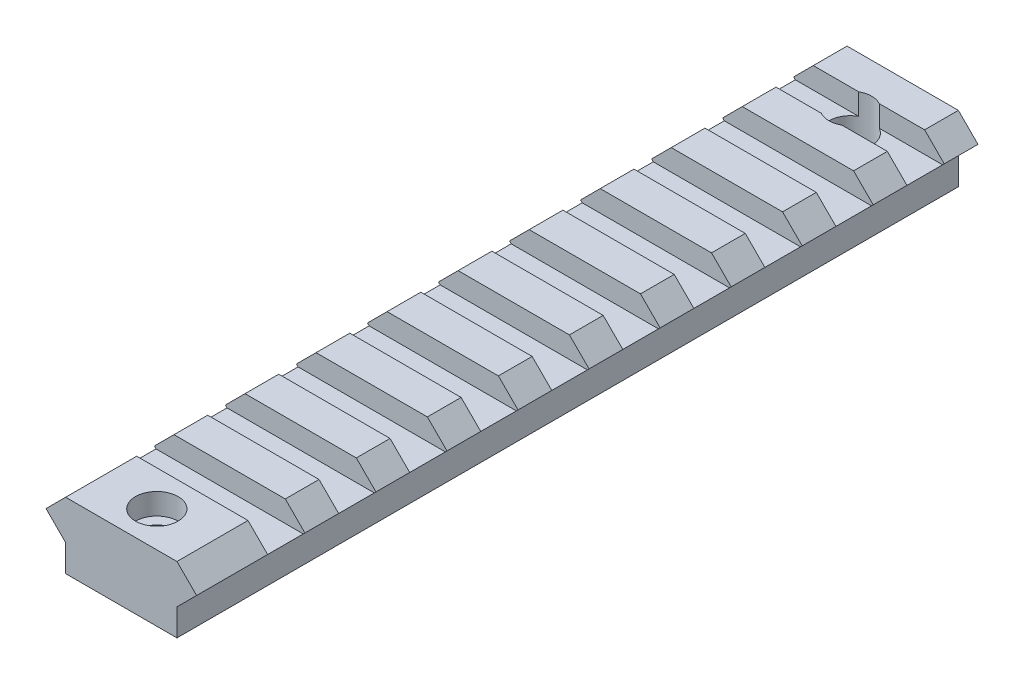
SolidWorks part; units mm, degrees
ref_plane "前视基准面" through (0, 0, 0) normal (0, 0, 1) x (1, 0, 0)
ref_plane "上视基准面" through (0, 0, 0) normal (0, 1, 0) x (1, 0, 0)
ref_plane "右视基准面" through (0, 0, 0) normal (1, 0, 0) x (0, 0, -1)
other "Configuration Table"
sketch "草图2" plane through (0, 0, 0) normal (0, 0, 1) x (1, 0, 0)
  line L0 (-26.0262, 29.9696) -> (-28.7912, 27.2046)
  line L1 (-28.7912, 29.9696) -> (-7.5912, 29.9696)
  line L2 (-28.7912, 29.9696) -> (-28.7912, 20.6496)
  line L3 (-28.7912, 20.6496) -> (-7.5912, 20.6496)
  line L4 (-7.5912, 29.9696) -> (-7.5912, 20.6496)
  line L5 (-28.7912, 29.9696) -> (-7.5912, 20.6496) construction
  line L6 (-28.7912, 20.6496) -> (-7.5912, 29.9696) construction
  line L7 (-26.0262, 20.6496) -> (-10.3562, 20.6496)
  line L8 (-26.0262, 20.6496) -> (-26.0262, 29.9696)
  line L9 (-26.0262, 29.9696) -> (-10.3562, 29.9696)
  line L10 (-10.3562, 20.6496) -> (-10.3562, 29.9696)
  line L11 (-26.0262, 20.6496) -> (-10.3562, 29.9696) construction
  line L12 (-26.0262, 29.9696) -> (-10.3562, 20.6496) construction
  line L13 (-28.7912, 27.2046) -> (-26.0262, 24.4396)
  line L14 (-18.1912, 29.9696) -> (-18.1912, 20.6496) construction
  line L15 (-7.5912, 27.2046) -> (-10.3562, 24.4396)
  line L16 (-10.3562, 29.9696) -> (-7.5912, 27.2046)
  point P0 (-18.1912, 25.3096)
  point P5 (-18.1912, 25.3096)
  dimension "D1" = 9.32
  dimension "D2" = 21.2
  dimension "D3" = 9.32
  dimension "D4" = 15.67
  dimension "D5" = 45
  dimension "D6" = 45
  dimension "D7" = 2.765
  dimension "D8" = 2.765
  dimension "D9" = 3.79
extrude "凸台-拉伸1" add sketch "草图2" along normal blind 110 contours L0 L13 L8 | L3 L10 L1 L8 | L16 L10 L15
sketch "草图3" plane through (0, 29.9696, 0) normal (0, 1, 0) x (1, 0, 0)
  line L1 (-28.7912, -4.75) -> (-7.5912, -4.75)
  line L2 (-28.7912, -4.75) -> (-28.7912, -10)
  line L3 (-28.7912, -10) -> (-7.5912, -10)
  line L4 (-7.5912, -4.75) -> (-7.5912, -10)
  line L6 (-28.7912, -14.75) -> (-28.7912, -20)
  line L7 (-26.0262, 0) -> (-10.3562, 0) construction
  line L8 (-28.7912, -14.75) -> (-7.5912, -14.75)
  line L9 (-7.5912, -14.75) -> (-7.5912, -20)
  line L10 (-28.7912, -20) -> (-7.5912, -20)
  line L11 (-28.7912, -24.75) -> (-28.7912, -30)
  line L12 (-28.7912, -24.75) -> (-7.5912, -24.75)
  line L13 (-7.5912, -24.75) -> (-7.5912, -30)
  line L14 (-28.7912, -30) -> (-7.5912, -30)
  line L15 (-28.7912, -34.75) -> (-28.7912, -40)
  line L16 (-28.7912, -34.75) -> (-7.5912, -34.75)
  line L17 (-7.5912, -34.75) -> (-7.5912, -40)
  line L18 (-28.7912, -40) -> (-7.5912, -40)
  line L19 (-28.7912, -44.75) -> (-28.7912, -50)
  line L20 (-28.7912, -44.75) -> (-7.5912, -44.75)
  line L21 (-7.5912, -44.75) -> (-7.5912, -50)
  line L22 (-28.7912, -50) -> (-7.5912, -50)
  line L23 (-28.7912, -54.75) -> (-28.7912, -60)
  line L24 (-28.7912, -54.75) -> (-7.5912, -54.75)
  line L25 (-7.5912, -54.75) -> (-7.5912, -60)
  line L26 (-28.7912, -60) -> (-7.5912, -60)
  line L27 (-28.7912, -64.75) -> (-28.7912, -70)
  line L28 (-28.7912, -64.75) -> (-7.5912, -64.75)
  line L29 (-7.5912, -64.75) -> (-7.5912, -70)
  line L30 (-28.7912, -70) -> (-7.5912, -70)
  line L31 (-28.7912, -74.75) -> (-28.7912, -80)
  line L32 (-28.7912, -74.75) -> (-7.5912, -74.75)
  line L33 (-7.5912, -74.75) -> (-7.5912, -80)
  line L34 (-28.7912, -80) -> (-7.5912, -80)
  line L35 (-28.7912, -84.75) -> (-28.7912, -90)
  line L36 (-28.7912, -84.75) -> (-7.5912, -84.75)
  line L37 (-7.5912, -84.75) -> (-7.5912, -90)
  line L38 (-28.7912, -90) -> (-7.5912, -90)
  line L39 (-28.7912, -94.75) -> (-28.7912, -100)
  line L40 (-28.7912, -94.75) -> (-7.5912, -94.75)
  line L41 (-7.5912, -94.75) -> (-7.5912, -100)
  line L42 (-28.7912, -100) -> (-7.5912, -100)
  line L43 (-18.1912, 0) -> (-18.1912, -22.7265) construction
  point P6 (-18.1912, -4.75)
  dimension "D1" = 5.25
  dimension "D2" = 10
  dimension "D4" = 21.2
  dimension "D3" = 10
extrude "切除-拉伸1" cut sketch "草图3" against normal blind 3
sketch "草图4" plane through (0, 29.9696, 0) normal (0, 1, 0) x (1, 0, 0)
  line L0 (-18.1912, -100) -> (-18.1912, -110) construction
  line L1 (-28.5562, -100) -> (-7.8262, -100) construction
  line L2 (-26.0262, -110) -> (-10.3562, -110) construction
  circle A0 centre (-18.1912, -105) radius 3
  dimension "D1" = 6
extrude "切除-拉伸2" cut sketch "草图4" against normal blind 3
sketch "草图5" plane through (0, 26.9696, 0) normal (0, 1, 0) x (1, 0, 0)
  circle A0 centre (-18.1912, -105) radius 1.5
  dimension "D1" = 3
extrude "切除-拉伸3" cut sketch "草图5" against normal through all
sketch "草图6" plane through (0, 26.9696, 0) normal (0, 1, 0) x (1, 0, 0)
  line L0 (-18.1912, -4.75) -> (-18.1912, -10) construction
  line L1 (-7.8262, -4.75) -> (-28.5562, -4.75) construction
  line L2 (-28.5562, -10) -> (-7.8262, -10) construction
  circle A0 centre (-18.1912, -7.375) radius 1.5
  dimension "D1" = 3
extrude "切除-拉伸4" cut sketch "草图6" against normal through all
sketch "草图7" plane through (0, 26.9696, 0) normal (0, 1, 0) x (1, 0, 0)
  circle A0 centre (-18.1912, -7.375) radius 3
  dimension "D1" = 6
extrude "切除-拉伸5" cut sketch "草图7" along normal through all and the other way blind 3
